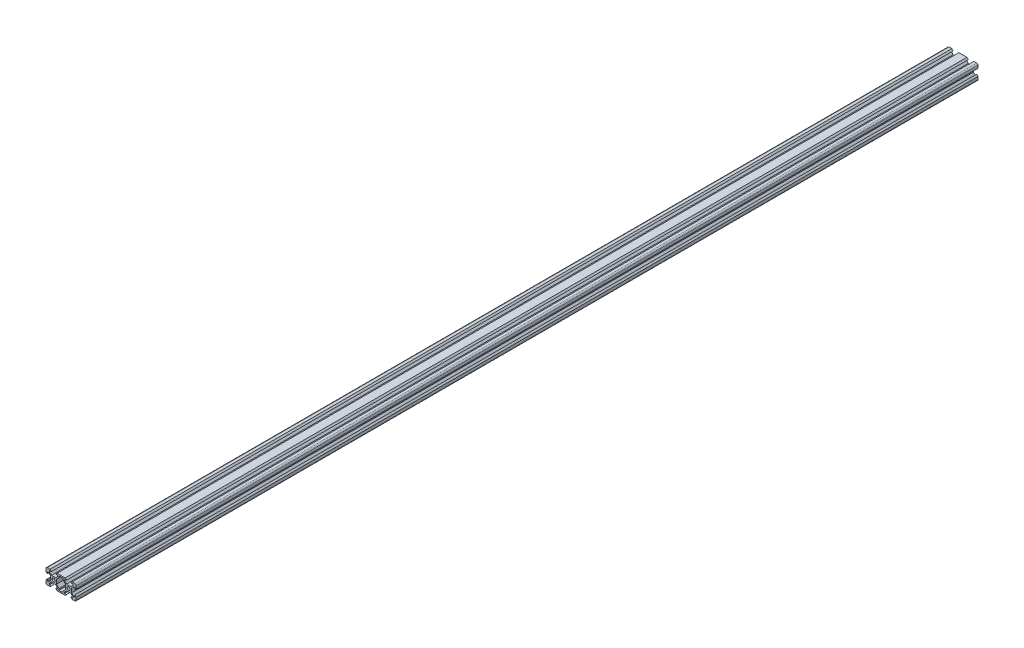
SolidWorks part; units mm, degrees
ref_plane "Front Plane" through (0, 0, 0) normal (0, 0, 1) x (1, 0, 0)
ref_plane "Top Plane" through (0, 0, 0) normal (0, 1, 0) x (1, 0, 0)
ref_plane "Right Plane" through (0, 0, 0) normal (1, 0, 0) x (0, 0, -1)
imported_body "Imported1"
sketch "Sketch1" plane through (0, 0, 25.4) normal (0, 0, 1) x (1, 0, 0)
  line L64 (-15.4993, -8.2) -> (-15.4993, -6.56)
  line L65 (-15.4993, -6.56) -> (-12.84, -3.9007)
  line L66 (-12.84, -3.9007) -> (-7.16, -3.9007)
  line L67 (-7.16, -3.9007) -> (-4.5007, -6.56)
  line L68 (-4.5007, -6.56) -> (-4.5007, -8.2)
  line L69 (-4.5007, -8.2) -> (-7.16, -8.2)
  line L70 (-7.16, -8.2) -> (-5.36, -10)
  line L71 (-5.36, -10) -> (5.36, -10)
  line L72 (5.36, -10) -> (7.16, -8.2)
  line L73 (7.16, -8.2) -> (4.5007, -8.2)
  line L74 (4.5007, -8.2) -> (4.5007, -6.56)
  line L75 (4.5007, -6.56) -> (7.16, -3.9007)
  line L76 (7.16, -3.9007) -> (12.84, -3.9007)
  line L77 (12.84, -3.9007) -> (15.4993, -6.56)
  line L78 (15.4993, -6.56) -> (15.4993, -8.2)
  line L79 (15.4993, -8.2) -> (12.84, -8.2)
  line L80 (12.84, -8.2) -> (14.64, -10)
  line L81 (14.64, -10) -> (18.2, -10)
  line L82 (20, -8.2) -> (20, -4.64)
  line L83 (20, -4.64) -> (18.2, -2.84)
  line L84 (18.2, -2.84) -> (18.2, -5.4993)
  line L85 (18.2, -5.4993) -> (16.56, -5.4993)
  line L86 (16.56, -5.4993) -> (13.9007, -2.84)
  line L87 (13.9007, -2.84) -> (13.9007, 2.84)
  line L88 (13.9007, 2.84) -> (16.56, 5.4993)
  line L89 (16.56, 5.4993) -> (18.2, 5.4993)
  line L90 (18.2, 5.4993) -> (18.2, 2.84)
  line L91 (18.2, 2.84) -> (20, 4.64)
  line L92 (20, 4.64) -> (20, 8.2)
  line L93 (18.2, 10) -> (14.64, 10)
  line L94 (14.64, 10) -> (12.84, 8.2)
  line L95 (12.84, 8.2) -> (15.4993, 8.2)
  line L96 (15.4993, 8.2) -> (15.4993, 6.56)
  line L97 (15.4993, 6.56) -> (12.84, 3.9007)
  line L98 (12.84, 3.9007) -> (7.16, 3.9007)
  line L99 (7.16, 3.9007) -> (4.5007, 6.56)
  line L100 (4.5007, 6.56) -> (4.5007, 8.2)
  line L101 (4.5007, 8.2) -> (7.16, 8.2)
  line L102 (7.16, 8.2) -> (5.36, 10)
  line L103 (5.36, 10) -> (-5.36, 10)
  line L104 (-5.36, 10) -> (-7.16, 8.2)
  line L105 (-7.16, 8.2) -> (-4.5007, 8.2)
  line L106 (-4.5007, 8.2) -> (-4.5007, 6.56)
  line L107 (-4.5007, 6.56) -> (-7.16, 3.9007)
  line L108 (-7.16, 3.9007) -> (-12.84, 3.9007)
  line L109 (-12.84, 3.9007) -> (-15.4993, 6.56)
  line L110 (-15.4993, 6.56) -> (-15.4993, 8.2)
  line L111 (-15.4993, 8.2) -> (-12.84, 8.2)
  line L112 (-12.84, 8.2) -> (-14.64, 10)
  line L113 (-14.64, 10) -> (-18.2, 10)
  line L114 (-20, 8.2) -> (-20, 4.64)
  line L115 (-20, 4.64) -> (-18.2, 2.84)
  line L116 (-18.2, 2.84) -> (-18.2, 5.4993)
  line L117 (-18.2, 5.4993) -> (-16.56, 5.4993)
  line L118 (-16.56, 5.4993) -> (-13.9007, 2.84)
  line L119 (-13.9007, 2.84) -> (-13.9007, -2.84)
  line L120 (-13.9007, -2.84) -> (-16.56, -5.4993)
  line L121 (-16.56, -5.4993) -> (-18.2, -5.4993)
  line L122 (-18.2, -5.4993) -> (-18.2, -2.84)
  line L123 (-18.2, -2.84) -> (-20, -4.64)
  line L124 (-20, -4.64) -> (-20, -8.2)
  line L125 (-18.2, -10) -> (-14.64, -10)
  line L126 (-14.64, -10) -> (-12.84, -8.2)
  line L127 (-12.84, -8.2) -> (-15.4993, -8.2)
  line L128 (-15.4993, -8.2) -> (-15.4993, -6.56)
  line L129 (-15.4993, -6.56) -> (-12.84, -3.9007)
  line L130 (-12.84, -3.9007) -> (-7.16, -3.9007)
  line L131 (-7.16, -3.9007) -> (-4.5007, -6.56)
  line L132 (-4.5007, -6.56) -> (-4.5007, -8.2)
  line L133 (-4.5007, -8.2) -> (-7.16, -8.2)
  line L134 (-7.16, -8.2) -> (-5.36, -10)
  line L135 (-5.36, -10) -> (5.36, -10)
  line L136 (5.36, -10) -> (7.16, -8.2)
  line L137 (7.16, -8.2) -> (4.5007, -8.2)
  line L138 (4.5007, -8.2) -> (4.5007, -6.56)
  line L139 (4.5007, -6.56) -> (7.16, -3.9007)
  line L140 (7.16, -3.9007) -> (12.84, -3.9007)
  line L141 (12.84, -3.9007) -> (15.4993, -6.56)
  line L142 (15.4993, -6.56) -> (15.4993, -8.2)
  line L143 (15.4993, -8.2) -> (12.84, -8.2)
  line L144 (12.84, -8.2) -> (14.64, -10)
  line L145 (14.64, -10) -> (18.2, -10)
  line L146 (20, -8.2) -> (20, -4.64)
  line L147 (20, -4.64) -> (18.2, -2.84)
  line L148 (18.2, -2.84) -> (18.2, -5.4993)
  line L149 (18.2, -5.4993) -> (16.56, -5.4993)
  line L150 (16.56, -5.4993) -> (13.9007, -2.84)
  line L151 (13.9007, -2.84) -> (13.9007, 2.84)
  line L152 (13.9007, 2.84) -> (16.56, 5.4993)
  line L153 (16.56, 5.4993) -> (18.2, 5.4993)
  line L154 (18.2, 5.4993) -> (18.2, 2.84)
  line L155 (18.2, 2.84) -> (20, 4.64)
  line L156 (20, 4.64) -> (20, 8.2)
  line L157 (18.2, 10) -> (14.64, 10)
  line L158 (14.64, 10) -> (12.84, 8.2)
  line L159 (12.84, 8.2) -> (15.4993, 8.2)
  line L160 (15.4993, 8.2) -> (15.4993, 6.56)
  line L161 (15.4993, 6.56) -> (12.84, 3.9007)
  line L162 (12.84, 3.9007) -> (7.16, 3.9007)
  line L163 (7.16, 3.9007) -> (4.5007, 6.56)
  line L164 (4.5007, 6.56) -> (4.5007, 8.2)
  line L165 (4.5007, 8.2) -> (7.16, 8.2)
  line L166 (7.16, 8.2) -> (5.36, 10)
  line L167 (5.36, 10) -> (-5.36, 10)
  line L168 (-5.36, 10) -> (-7.16, 8.2)
  line L169 (-7.16, 8.2) -> (-4.5007, 8.2)
  line L170 (-4.5007, 8.2) -> (-4.5007, 6.56)
  line L171 (-4.5007, 6.56) -> (-7.16, 3.9007)
  line L172 (-7.16, 3.9007) -> (-12.84, 3.9007)
  line L173 (-12.84, 3.9007) -> (-15.4993, 6.56)
  line L174 (-15.4993, 6.56) -> (-15.4993, 8.2)
  line L175 (-15.4993, 8.2) -> (-12.84, 8.2)
  line L176 (-12.84, 8.2) -> (-14.64, 10)
  line L177 (-14.64, 10) -> (-18.2, 10)
  line L178 (-20, 8.2) -> (-20, 4.64)
  line L179 (-20, 4.64) -> (-18.2, 2.84)
  line L180 (-18.2, 2.84) -> (-18.2, 5.4993)
  line L181 (-18.2, 5.4993) -> (-16.56, 5.4993)
  line L182 (-16.56, 5.4993) -> (-13.9007, 2.84)
  line L183 (-13.9007, 2.84) -> (-13.9007, -2.84)
  line L184 (-13.9007, -2.84) -> (-16.56, -5.4993)
  line L185 (-16.56, -5.4993) -> (-18.2, -5.4993)
  line L186 (-18.2, -5.4993) -> (-18.2, -2.84)
  line L187 (-18.2, -2.84) -> (-20, -4.64)
  line L188 (-20, -4.64) -> (-20, -8.2)
  line L189 (-18.2, -10) -> (-14.64, -10)
  line L190 (-14.64, -10) -> (-12.84, -8.2)
  line L191 (-12.84, -8.2) -> (-15.4993, -8.2)
  line L322 (-2.6993, 8.2) -> (-2.6993, 6.24) construction
  line L323 (2.6993, 8.2) -> (-2.6993, 8.2) construction
  line L324 (2.6993, 6.24) -> (2.6993, 8.2) construction
  line L325 (6.0993, 2.84) -> (2.6993, 6.24) construction
  line L326 (6.0993, -2.84) -> (6.0993, 2.84) construction
  line L327 (2.6993, -6.24) -> (6.0993, -2.84) construction
  line L328 (2.6993, -8.2) -> (2.6993, -6.24) construction
  line L329 (-2.6993, -8.2) -> (2.6993, -8.2) construction
  line L330 (-2.6993, -6.24) -> (-2.6993, -8.2) construction
  line L331 (-6.0993, -2.84) -> (-2.6993, -6.24) construction
  line L332 (-6.0993, 2.84) -> (-6.0993, -2.84) construction
  line L333 (-2.6993, 6.24) -> (-6.0993, 2.84) construction
  line L334 (-2.6993, 8.2) -> (-2.6993, 6.24)
  line L335 (2.6993, 8.2) -> (-2.6993, 8.2)
  line L336 (2.6993, 6.24) -> (2.6993, 8.2)
  line L337 (6.0993, 2.84) -> (2.6993, 6.24)
  line L338 (6.0993, -2.84) -> (6.0993, 2.84)
  line L339 (2.6993, -6.24) -> (6.0993, -2.84)
  line L340 (2.6993, -8.2) -> (2.6993, -6.24)
  line L341 (-2.6993, -8.2) -> (2.6993, -8.2)
  line L342 (-2.6993, -6.24) -> (-2.6993, -8.2)
  line L343 (-6.0993, -2.84) -> (-2.6993, -6.24)
  line L344 (-6.0993, 2.84) -> (-6.0993, -2.84)
  line L345 (-2.6993, 6.24) -> (-6.0993, 2.84)
  circle A1 centre (-10, 0) radius 2.1
  circle A2 centre (-10, 0) radius 2.1
  circle A3 centre (10, 0) radius 2.1
  circle A4 centre (10, 0) radius 2.1
  arc A8 (18.2, -10) -> (20, -8.2) centre (18.2, -8.2) ccw
  arc A9 (20, 8.2) -> (18.2, 10) centre (18.2, 8.2) ccw
  arc A10 (-18.2, 10) -> (-20, 8.2) centre (-18.2, 8.2) ccw
  arc A11 (-20, -8.2) -> (-18.2, -10) centre (-18.2, -8.2) ccw
  arc A12 (18.2, -10) -> (20, -8.2) centre (18.2, -8.2) ccw
  arc A13 (20, 8.2) -> (18.2, 10) centre (18.2, 8.2) ccw
  arc A14 (-18.2, 10) -> (-20, 8.2) centre (-18.2, 8.2) ccw
  arc A15 (-20, -8.2) -> (-18.2, -10) centre (-18.2, -8.2) ccw
  dimension "D1" = 0
  dimension "D2" = 0
  dimension "D3" = 0
extrude "Boss-Extrude1" add sketch "Sketch1" along normal blind 1168.4
